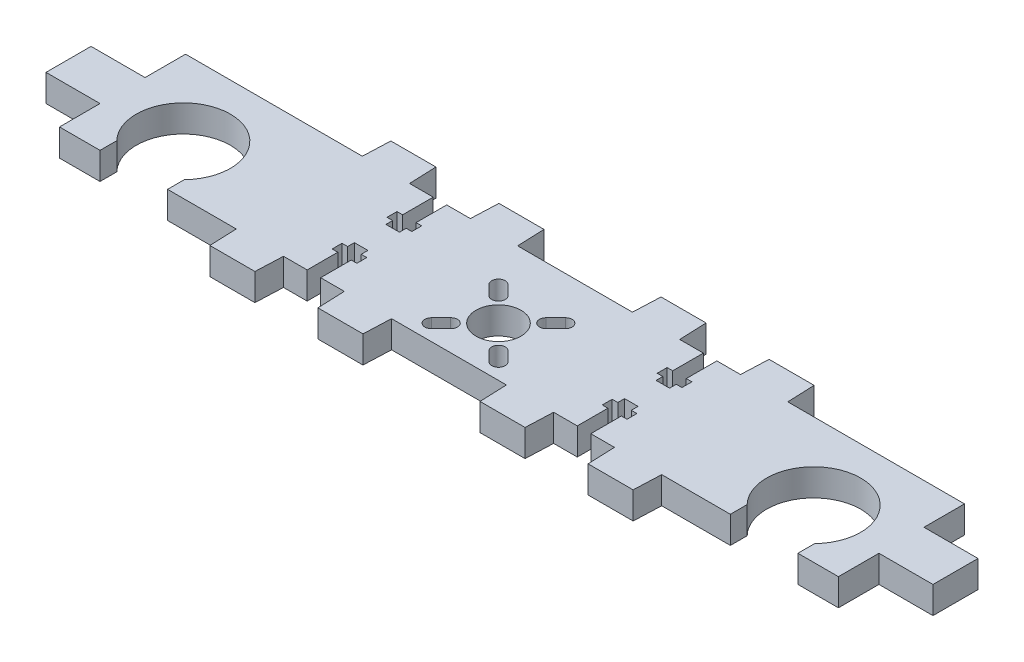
SolidWorks part; units mm, degrees
ref_plane "Спереди" through (0, 0, 0) normal (0, 0, 1) x (1, 0, 0)
ref_plane "Сверху" through (0, 0, 0) normal (0, 1, 0) x (1, 0, 0)
ref_plane "Справа" through (0, 0, 0) normal (1, 0, 0) x (0, 0, -1)
sketch "Эскиз1" plane through (0, 0, 0) normal (0, 1, 0) x (1, 0, 0)
  line L0 (0, 79.5064) -> (0, 0) construction
  line L1 (0, 0) -> (104.1626, 0) construction
  line L2 (0, -11) -> (12.75, -11)
  line L3 (86.5, -11) -> (86.5, -2)
  line L4 (86.5, 17) -> (47.25, 17)
  line L5 (0, -5) -> (0, -11)
  line L6 (77.5, -7.2768) -> (77.5, -11)
  line L7 (70, 0) -> (70, 14.1666) construction
  line L8 (62.5, -7.2768) -> (62.5, -11)
  line L9 (77.5, -11) -> (86.5, -11)
  line L10 (0, 17) -> (0, 5)
  line L11 (86.5, -2) -> (98.5, -2)
  line L12 (98.5, -2) -> (98.5, 8)
  line L13 (98.5, 8) -> (86.5, 8)
  line L14 (86.5, 8) -> (86.5, 17)
  line L15 (12.75, 17) -> (13, 23.1)
  line L16 (13, 23.1) -> (23, 23.1)
  line L17 (23, 23.1) -> (23.25, 17)
  line L18 (28.5, 17) -> (28.5, 10.2)
  line L19 (28.5, 10.2) -> (27.25, 10.2)
  line L20 (27.25, 10.2) -> (27.25, 8)
  line L21 (27.25, 8) -> (28.5, 8)
  line L22 (28.5, 8) -> (28.5, 6.5)
  line L23 (28.5, 6.5) -> (31.5, 6.5)
  line L24 (30, 6.5) -> (30, 17) construction
  line L25 (12.75, 17) -> (0, 17)
  line L26 (31.5, 8) -> (31.5, 6.5)
  line L27 (32.75, 8) -> (31.5, 8)
  line L28 (32.75, 10.2) -> (32.75, 8)
  line L29 (31.5, 10.2) -> (32.75, 10.2)
  line L30 (31.5, 17) -> (31.5, 10.2)
  line L31 (28.5, 17) -> (23.25, 17)
  line L32 (18, 23.1) -> (18, 15.979) construction
  line L33 (47.25, 17) -> (47, 23.1)
  line L34 (37, 23.1) -> (36.75, 17)
  line L35 (47, 23.1) -> (37, 23.1)
  line L36 (36.75, 17) -> (31.5, 17)
  line L37 (98.5, 3) -> (90, 3) construction
  line L38 (31.5, -11) -> (31.5, -4.2)
  line L39 (31.5, -4.2) -> (32.75, -4.2)
  line L40 (32.75, -4.2) -> (32.75, -2)
  line L41 (32.75, -2) -> (31.5, -2)
  line L42 (31.5, -2) -> (31.5, -0.5)
  line L43 (28.5, -0.5) -> (31.5, -0.5)
  line L44 (28.5, -2) -> (28.5, -0.5)
  line L45 (27.25, -2) -> (28.5, -2)
  line L46 (27.25, -4.2) -> (27.25, -2)
  line L47 (28.5, -4.2) -> (27.25, -4.2)
  line L48 (28.5, -11) -> (28.5, -4.2)
  line L49 (47, -17.1) -> (37, -17.1)
  line L50 (37, -17.1) -> (36.75, -11)
  line L51 (47.25, -11) -> (47, -17.1)
  line L52 (23, -17.1) -> (23.25, -11)
  line L53 (13, -17.1) -> (23, -17.1)
  line L54 (12.75, -11) -> (13, -17.1)
  line L55 (23.25, -11) -> (28.5, -11)
  line L56 (31.5, -11) -> (36.75, -11)
  line L57 (47.25, -11) -> (62.5, -11)
  line L58 (0, 0) -> (9.3932, 9.3932) construction
  line L59 (5.3033, 5.3033) -> (7.4246, 7.4246) construction
  line L60 (4.2426, 6.364) -> (6.364, 8.4853)
  line L61 (6.364, 4.2426) -> (8.4853, 6.364)
  line L62 (5.3033, -5.3033) -> (7.4246, -7.4246) construction
  line L63 (4.2426, -6.364) -> (6.364, -8.4853)
  line L64 (6.364, -4.2426) -> (8.4853, -6.364)
  arc A0 (0, -5) -> (0, 5) centre (0, 0) ccw
  arc A1 (77.5, -7.2768) -> (62.5, -7.2768) centre (70, 0) ccw
  circle A2 centre (0, 0) radius 7.5 construction
  arc A3 (4.2426, 6.364) -> (6.364, 4.2426) centre (5.3033, 5.3033) ccw
  arc A4 (8.4853, 6.364) -> (6.364, 8.4853) centre (7.4246, 7.4246) ccw
  arc A5 (4.2426, -6.364) -> (6.364, -4.2426) centre (5.3033, -5.3033) cw
  arc A6 (8.4853, -6.364) -> (6.364, -8.4853) centre (7.4246, -7.4246) cw
  point P70 (6.364, 6.364)
  point P77 (6.364, -6.364)
  dimension "D2" = 10
  dimension "D3" = 20.9
  dimension "D4" = 140
  dimension "D5" = 15
  dimension "D21" = 1.5
  dimension "D1" = 173
  dimension "D6" = 11
  dimension "D7" = 15
  dimension "D8" = 9
  dimension "D9" = 10
  dimension "D10" = 12
  dimension "D11" = 30
  dimension "D12" = 6.1
  dimension "D13" = 10
  dimension "D14" = 10.5
  dimension "D15" = 3
  dimension "D16" = 2.2
  dimension "D17" = 1.5
  dimension "D18" = 5.5
  dimension "D19" = 10.5
  dimension "D20" = 12
  dimension "D22" = 3
  dimension "D23" = 45
extrude "Бобышка-Вытянуть1" add sketch "Эскиз1" along normal blind 6
mirror "Зеркальное отражение1" about plane through (0, 6, -17) normal (1, 0, 0)
